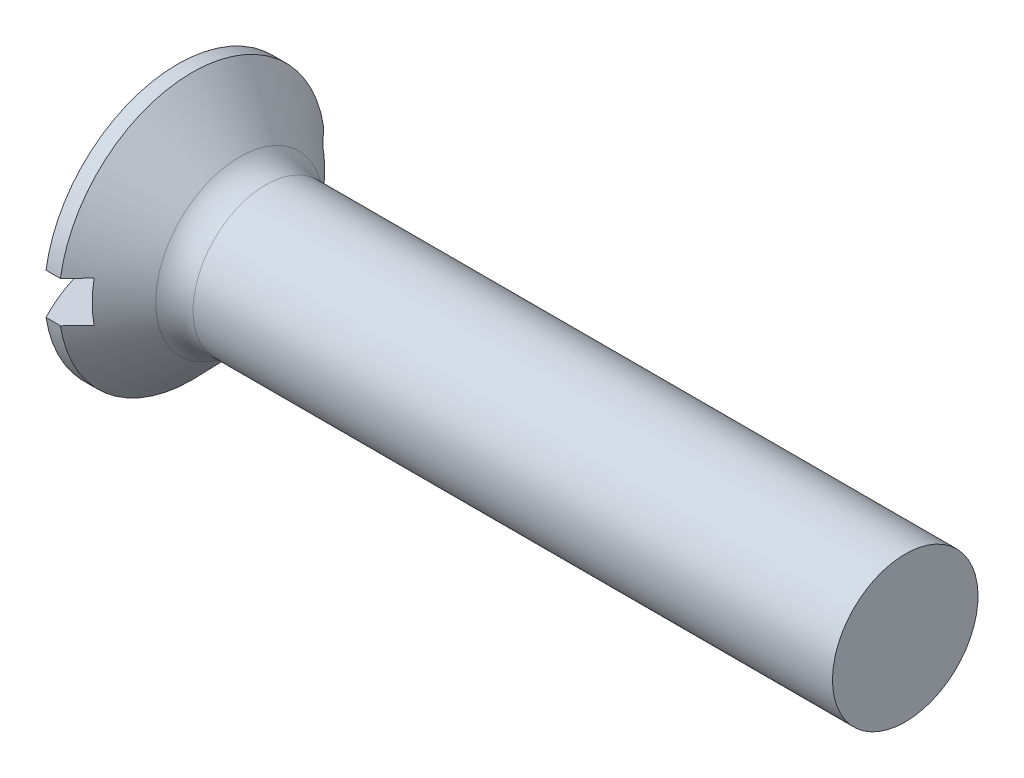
SolidWorks part; units mm, degrees
ref_plane "Front Plane" through (0, 0, 0) normal (0, 0, 1) x (1, 0, 0)
ref_plane "Top Plane" through (0, 0, 0) normal (0, 1, 0) x (1, 0, 0)
ref_plane "Right Plane" through (0, 0, 0) normal (1, 0, 0) x (0, 0, -1)
sketch "BodySke" plane through (0, 0, 0) normal (0, 0, 1) x (1, 0, 0)
  line L0 (2.28, 0) -> (111.3824, 0) construction
  line L1 (2.28, 0) -> (2.28, 9.15) construction
  line L2 (2.28, 9.15) -> (3.2724, 9.15)
  line L3 (3.2724, 9.15) -> (7.28, 5)
  line L4 (7.28, 5) -> (52.28, 5)
  line L5 (52.28, 5) -> (52.28, 0)
  line L6 (8.78, 8.824) -> (8.78, -5.8939) construction
  line L7 (2.28, 0) -> (52.28, 0)
  line L8 (10.28, 8.824) -> (10.28, -4.958) construction
  line L9 (2.28, -9.15) -> (3.2724, -9.15) construction
  line L10 (3.2724, -9.15) -> (7.28, -5) construction
  line L11 (7.28, -5) -> (52.28, -5) construction
  line L12 (2.28, 0) -> (-13.4753, 0) construction
  line L13 (0, 0) -> (0, 11.6167) construction
  line L14 (2.28, 0) -> (0, 0)
  arc A0 (0, 0) -> (2.28, 9.15) centre (19.5, 0) cw
  point P10 (52.28, 4.172)
  dimension "Head_radius" = 19.5
  dimension "Diameter" = 10
  dimension "Head_dia" = 18.3
  dimension "Head_height" = 5
  dimension "Length" = 50
  dimension "Advance" = 1.5
  dimension "Thread_minor" = 8.344
  dimension "Head_angle" = 92
  dimension "Tread_runout" = 3
revolve "BaseBody" add sketch "BodySke" angle 360 about L0
fillet "Fillet1" radius 2.5 1 edges at (7.28, -5, 0)
sketch "SlotSke" plane through (0, 0, 0) normal (1, 0, 0) x (0, 0, -1)
  line L1 (-9.15, 1.405) -> (9.15, 1.405)
  line L2 (-9.15, 1.405) -> (-9.15, -1.405)
  line L3 (-9.15, -1.405) -> (9.15, -1.405)
  line L4 (9.15, 1.405) -> (9.15, -1.405)
  dimension "D1" = 18.3
  dimension "D2" = 9.15
  dimension "D3" = 1.405
  dimension "Slot_width" = 2.81
extrude "Slot" cut sketch "SlotSke" along normal blind 4.4
sketch "ThdSchSke" plane through (0, 0, 0) normal (0, 0, 1) x (1, 0, 0)
  line L0 (0, 0) -> (55.1256, 0) construction
  line L1 (2.28, 0) -> (111.3824, 0) construction
  line L2 (51.802, 5) -> (51.802, 5.9561)
  line L3 (51.802, 5.9561) -> (52.7581, 5.9561)
  line L4 (52.7581, 5.9561) -> (52.7581, 5)
  line L5 (52.7581, 5) -> (52.28, 4.172)
  line L6 (52.28, 4.172) -> (51.802, 5)
  line L7 (7.28, 5) -> (52.28, 5) construction
  line L13 (52.28, 5) -> (52.28, 0) construction
revolve "ThreadSchematic" [suppressed] cut sketch "ThdSchSke" angle 360 about L0
pattern_linear "ThdSchPat" [suppressed] count 29 along (1, 0, 0)
equation "\"Thread_minor@ThreadCosmetic\" = \"Thread_minor@BodySke\""
equation "\"D1@SlotSke\" = \"Head_dia@BodySke\""
equation "\"D2@SlotSke\" = \"D1@SlotSke\" / 2"
equation "\"D3@SlotSke\" = \"Slot_width@SlotSke\" / 2"
equation "\"Advance@ThdSchPat\" = \"Advance@BodySke\""
equation "\"D1@ThdSchPat\" =  int( (  \"Length@BodySke\"-\"Head_height@BodySke\"-\"Tread_runout@BodySke\" )  / \"Advance@ThdSchPat\" )+1 "
